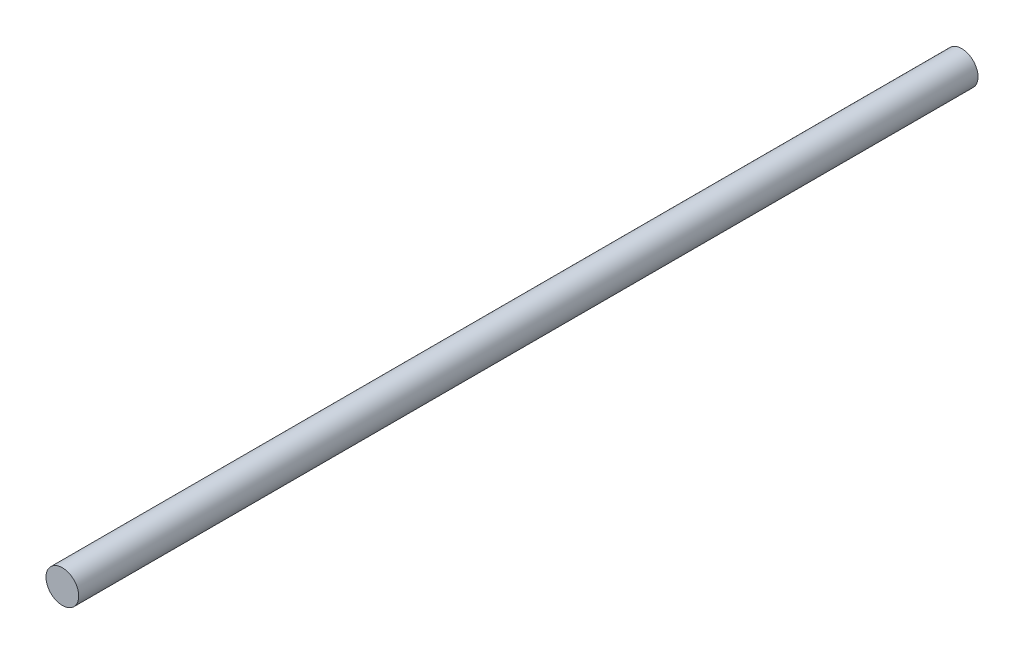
SolidWorks part; units mm, degrees
ref_plane "Front Plane" through (0, 0, 0) normal (0, 0, 1) x (1, 0, 0)
ref_plane "Top Plane" through (0, 0, 0) normal (0, 1, 0) x (1, 0, 0)
ref_plane "Right Plane" through (0, 0, 0) normal (1, 0, 0) x (0, 0, -1)
sketch "Sketch1" plane through (0, 0, 0) normal (0, 0, 1) x (1, 0, 0)
  circle A0 centre (0, 0) radius 1.5
  dimension "D1" = 3
extrude "Boss-Extrude1" add sketch "Sketch1" along normal blind 82.4
sketch "Sketch3" plane through (0, 0, 82.4) normal (0, 0, 1) x (1, 0, 0)
  point P0 (0, 0)
sketch "Sketch4" plane through (0, 0, 0) normal (0, 0, -1) x (-1, 0, 0)
  point P0 (0, 0)
